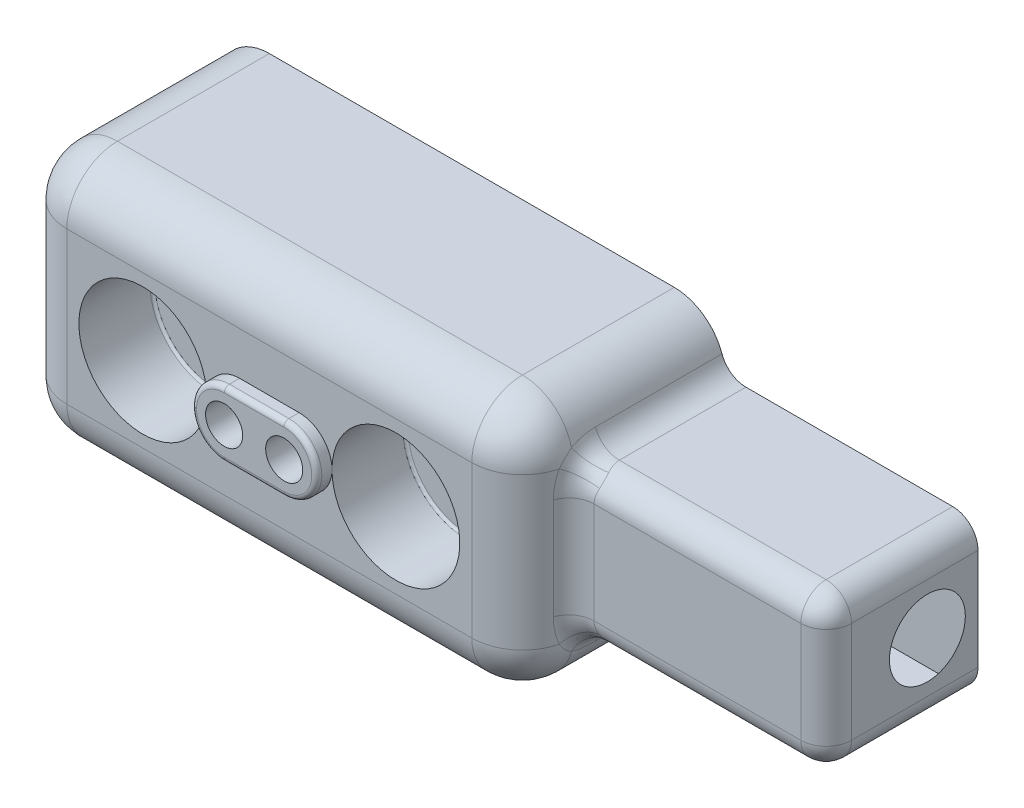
SolidWorks part; units mm, degrees
ref_plane "Спереди" through (0, 0, 0) normal (0, 0, 1) x (1, 0, 0)
ref_plane "Сверху" through (0, 0, 0) normal (0, 1, 0) x (1, 0, 0)
ref_plane "Справа" through (0, 0, 0) normal (1, 0, 0) x (0, 0, -1)
sketch "Эскиз1" plane through (0, 0, 0) normal (0, 0, 1) x (1, 0, 0)
  line L1 (-10, 5) -> (10, 5)
  line L2 (-10, 5) -> (-10, -5)
  line L3 (-10, -5) -> (10, -5)
  line L4 (10, 5) -> (10, -5)
  line L5 (-10, 5) -> (10, -5) construction
  line L6 (-10, -5) -> (10, 5) construction
  point P0 (0, 0)
  dimension "D1" = 20
  dimension "D2" = 10
extrude "Бобышка-Вытянуть1" add sketch "Эскиз1" against normal blind 8 contours L3 L4 L1 L2
other "Полость1"
other "mag_5x3mm<2>@Pebble_charger_assembly1"
other "mag_5x3mm<1>@Pebble_charger_assembly1"
other "plunge_pin<1>@Pebble_charger_assembly1"
sketch "Эскиз2" plane through (0, 0, -2.9) normal (0, 0, 1) x (1, 0, 0)
  circle A0 centre (5, 0) radius 1
  circle A1 centre (-5, 0) radius 1
  dimension "D1" = 2
extrude "Вырез-Вытянуть1" cut sketch "Эскиз2" against normal through all
sketch "Эскиз3" plane through (0, 0, -8) normal (0, 0, -1) x (-1, 0, 0)
  line L1 (-2.626, 1.3887) -> (2.626, 1.3887)
  line L2 (-2.626, 1.3887) -> (-2.626, -1.3887)
  line L3 (-2.626, -1.3887) -> (2.626, -1.3887)
  line L4 (2.626, 1.3887) -> (2.626, -1.3887)
  line L5 (-2.626, 1.3887) -> (2.626, -1.3887) construction
  line L6 (-2.626, -1.3887) -> (2.626, 1.3887) construction
  point P0 (0, 0)
  dimension "D1" = 5.252
  dimension "D2" = 2.7775
extrude "Вырез-Вытянуть3" cut sketch "Эскиз3" against normal up to vertex
sketch "Эскиз4" plane through (0, 0, 0) normal (0, 0, 1) x (1, 0, 0)
  circle A0 centre (1.1868, 0) radius 0.7323 construction
  circle A1 centre (-1.1868, 0) radius 0.7322 construction
  circle A2 centre (1.1868, 0) radius 0.7323
  circle A3 centre (-1.1868, 0) radius 0.7322
extrude "Вырез-Вытянуть4" cut sketch "Эскиз4" against normal up to next
fillet "Скругление1" radius 2 8 edges at (-10, 5, -4) (10, 5, -4) (10, -5, -4) (-10, -5, -4) (-10, 0, 0) (0, 5, 0) (10, 0, 0) (0, -5, 0)
sketch "Эскиз5" plane through (0, 0, -8) normal (0, 0, -1) x (-1, 0, 0)
  line L0 (-2.626, -1.3887) -> (2.626, -1.3887) construction
  line L1 (-6, 1.3887) -> (6, 1.3887)
  line L2 (-6, 1.3887) -> (-6, -1.3887)
  line L3 (-6, -1.3887) -> (6, -1.3887)
  line L4 (6, 1.3887) -> (6, -1.3887)
  line L5 (-6, 1.3887) -> (6, -1.3887) construction
  line L6 (-6, -1.3887) -> (6, 1.3887) construction
  circle A0 centre (-5, 0) radius 1 construction
  point P0 (0, 0)
extrude "Вырез-Вытянуть5" cut sketch "Эскиз5" against normal blind 2
sketch "Эскиз6" plane through (10, 0, 0) normal (1, 0, 0) x (0, 0, -1)
  line L0 (8, 3) -> (8, -3) construction
  circle A0 centre (6, 0) radius 1.5
  dimension "D1" = 3
  dimension "D2" = 2
extrude "Вырез-Вытянуть9" cut sketch "Эскиз6" against normal up to surface (16 mm away)
sketch "Эскиз7" plane through (0, 0, 0) normal (0, 0, 1) x (1, 0, 0)
  line L0 (-1.175, 0) -> (1.175, 0) construction
  line L1 (-1.175, 1.3) -> (1.175, 1.3)
  line L2 (-1.175, -1.3) -> (1.175, -1.3)
  arc A0 (-1.175, 1.3) -> (-1.175, -1.3) centre (-1.175, 0) ccw
  arc A1 (1.175, -1.3) -> (1.175, 1.3) centre (1.175, 0) ccw
  circle A2 centre (5, 0) radius 2.525 construction
  circle A3 centre (1.1868, 0) radius 0.7323 construction
  circle A4 centre (-1.1868, 0) radius 0.7322 construction
  circle A5 centre (1.1868, 0) radius 0.7323
  circle A6 centre (-1.1868, 0) radius 0.7322
  point P4 (0, 0)
extrude "Бобышка-Вытянуть2" add sketch "Эскиз7" along normal blind 0.6
fillet "Скругление2" radius 0.2 4 edges at (0, -1.3, 0.6) (-2.475, 0, 0.6) (0, 1.3, 0.6) (2.475, 0, 0.6)
sketch "Эскиз8" plane through (10, 0, 0) normal (1, 0, 0) x (0, 0, -1)
  line L4 (8, -3) -> (8, 3)
  line L5 (8, 3) -> (2, 3)
  line L6 (2, 3) -> (2, -3)
  line L7 (2, -3) -> (8, -3)
  line L8 (8, -3) -> (8, 3)
  line L9 (8, 3) -> (2, 3)
  line L10 (2, 3) -> (2, -3)
  line L11 (2, -3) -> (8, -3)
  circle A0 centre (6, 0) radius 1.5 construction
  circle A1 centre (6, 0) radius 1.5
  dimension "D1" = 0
extrude "Бобышка-Вытянуть3" add sketch "Эскиз8" along normal blind 10
fillet "Скругление3" radius 1 5 edges at (20, -3, -5) (20, 0, -2) (20, 3, -5) (15, -3, -2) (15, 3, -2)
fillet "Скругление4" radius 1 7 edges at (10, -3, -5.5) (9.9992, -2.9439, -2.6697) (9.9974, -2.4387, -2.1014) (10, 3, -5.5) (9.9974, 2.8986, -2.5613) (9.9992, 2.3303, -2.0561) (10, 0, -2)
sketch "Эскиз9" plane through (6, 0, 0) normal (-1, 0, 0) x (0, 0, 1)
  line L3 (-8, -1.3887) -> (-6.5669, -1.3887)
  line L4 (-6.5669, 1.3887) -> (-8, 1.3887)
  line L5 (-8, 1.3887) -> (-8, -1.3887)
  line L6 (-8, -1.3887) -> (-6.5669, -1.3887)
  line L7 (-6.5669, 1.3887) -> (-8, 1.3887)
  line L8 (-8, 1.3887) -> (-8, -1.3887)
  arc A1 (-6.5669, 1.3887) -> (-6.5669, -1.3887) centre (-6, 0) ccw
  arc A2 (-6.5669, 1.3887) -> (-6.5669, -1.3887) centre (-6, 0) ccw
  dimension "D1" = 0
extrude "Вырез-Вытянуть10" cut sketch "Эскиз9" against normal blind 8
